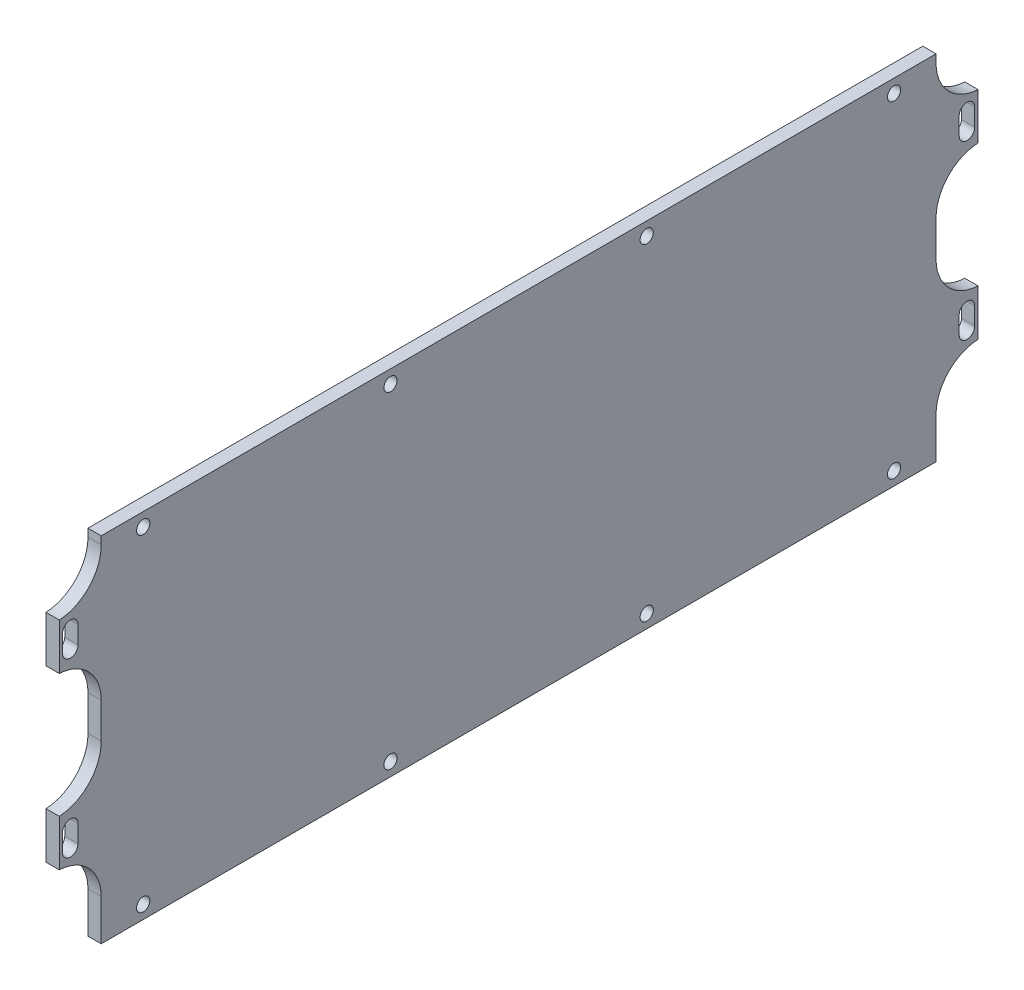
SolidWorks part; units mm, degrees
ref_plane "Front" through (0, 0, 0) normal (0, 0, 1) x (1, 0, 0)
ref_plane "Top" through (0, 0, 0) normal (0, 1, 0) x (1, 0, 0)
ref_plane "Right" through (0, 0, 0) normal (1, 0, 0) x (0, 0, -1)
sketch "Эскиз1" plane through (0, 0, 0) normal (1, 0, 0) x (0, 0, -1)
  line L1 (-104.5, -42) -> (104.5, -42)
  line L2 (-104.5, -42) -> (-104.5, 42)
  line L3 (-104.5, 42) -> (104.5, 42)
  line L4 (104.5, -42) -> (104.5, 42)
  line L5 (-104.5, -42) -> (104.5, 42) construction
  line L6 (-104.5, 42) -> (104.5, -42) construction
  point P0 (0, 0)
  dimension "D1" = 209
  dimension "D2" = 84
extrude "Бобышка-Вытянуть1" add sketch "Эскиз1" along normal blind 3
sketch "Эскиз2" plane through (3, 0, 0) normal (1, 0, 0) x (0, 0, -1)
  line L0 (104.5, 21.25) -> (101.5, 21.25) construction
  line L1 (104.5, 21.25) -> (119.9005, 21.25) construction
  line L2 (104.5, 32) -> (104.5, 12.5261) construction
  line L3 (104.5, -42) -> (104.5, 42) construction
  line L4 (101.5, 21.25) -> (101.5, -17.75) construction
  line L5 (0, 42) -> (0, 21.25) construction
  line L6 (104.5, 42) -> (-104.5, 42) construction
  circle A0 centre (101.5, 21.25) radius 1.75
  circle A1 centre (101.5, -17.75) radius 1.75
  circle A2 centre (-101.5, -17.75) radius 1.75
  circle A3 centre (-101.5, 21.25) radius 1.75
  dimension "D2" = 3.5
  dimension "D4" = 3.5
  dimension "D1" = 3
  dimension "D3" = 39
extrude "Вырез-Вытянуть1" cut sketch "Эскиз2" against normal blind 10
sketch "Эскиз4" plane through (0, -42, 0) normal (0, -1, 0) x (-1, 0, 0)
  circle A0 centre (-1.6741, 1.2422) radius 175.4879
extrude "Вырез-Вытянуть3" cut sketch "Эскиз4" against normal blind 2
sketch "Эскиз5" plane through (0, 42, 0) normal (0, 1, 0) x (1, 0, 0)
  circle A0 centre (1.5428, -2.303) radius 130.715
extrude "Вырез-Вытянуть4" cut sketch "Эскиз5" against normal blind 2
sketch "Эскиз6" plane through (3, 0, 0) normal (1, 0, 0) x (0, 0, -1)
  line L0 (101.5, 21.25) -> (101.5, 24.25) construction
  line L1 (101.5, 24.25) -> (104.5, 24.25) construction
  line L2 (104.5, -40) -> (104.5, 40) construction
  line L3 (101.5, -17.75) -> (101.5, -20.75) construction
  line L4 (104.5, 24.25) -> (94.5, 24.25)
  line L5 (104.5, 24.25) -> (104.5, 43.8315)
  line L6 (104.5, 43.8315) -> (94.5, 43.8315)
  line L7 (94.5, 24.25) -> (94.5, 43.8315)
  line L8 (101.5, -20.75) -> (104.5, -20.75) construction
  line L9 (0, 0) -> (0, -11.4512) construction
  line L10 (104.5, -20.75) -> (94.5, -20.75)
  line L11 (104.5, -20.75) -> (104.5, -47.1827)
  line L12 (104.5, -47.1827) -> (94.5, -47.1827)
  line L13 (94.5, -20.75) -> (94.5, -47.1827)
  line L14 (-104.5, -47.1827) -> (-94.5, -47.1827)
  line L15 (-104.5, -20.75) -> (-104.5, -47.1827)
  line L16 (-104.5, -20.75) -> (-94.5, -20.75)
  line L17 (-94.5, -20.75) -> (-94.5, -47.1827)
  line L18 (-104.5, 24.25) -> (-104.5, 43.8315)
  line L19 (-104.5, 43.8315) -> (-94.5, 43.8315)
  line L20 (-94.5, 24.25) -> (-94.5, 43.8315)
  line L21 (-104.5, 24.25) -> (-94.5, 24.25)
  dimension "D1" = 3
  dimension "D2" = 10
  dimension "D3" = 3
  dimension "D4" = 10
extrude "Вырез-Вытянуть5" cut sketch "Эскиз6" against normal blind 10
sketch "Эскиз7" plane through (3, 0, 0) normal (1, 0, 0) x (0, 0, -1)
  line L0 (104.5, 1.75) -> (99.5, 1.75) construction
  line L1 (104.5, -20.75) -> (104.5, 24.25) construction
  line L2 (0, 0) -> (0, 21.92) construction
  line L3 (94.5, 17.75) -> (104.5, 17.75)
  line L4 (94.5, 17.75) -> (94.5, -14.25)
  line L5 (94.5, -14.25) -> (104.5, -14.25)
  line L6 (104.5, 17.75) -> (104.5, -14.25)
  line L7 (94.5, 17.75) -> (104.5, -14.25) construction
  line L8 (94.5, -14.25) -> (104.5, 17.75) construction
  line L9 (-94.5, -14.25) -> (-104.5, -14.25)
  line L10 (-94.5, 17.75) -> (-94.5, -14.25)
  line L11 (-94.5, 17.75) -> (-104.5, 17.75)
  line L12 (-104.5, 17.75) -> (-104.5, -14.25)
  dimension "D1" = 5
  dimension "D2" = 32
extrude "Вырез-Вытянуть6" cut sketch "Эскиз7" against normal blind 10
sketch "Эскиз8" plane through (3, 0, 0) normal (1, 0, 0) x (0, 0, -1)
  line L0 (0, 0) -> (29.6404, 0) construction
  line L3 (0, 0) -> (0, 37) construction
  line L4 (0, 37) -> (-29, 37) construction
  line L5 (-29, 37) -> (-85, 37) construction
  circle A0 centre (-29, 37) radius 1.5
  circle A1 centre (-85, 37) radius 1.5
  circle A2 centre (85, 37) radius 1.5
  circle A3 centre (29, 37) radius 1.5
  circle A4 centre (-85, -37) radius 1.5
  circle A5 centre (-29, -37) radius 1.5
  circle A6 centre (29, -37) radius 1.5
  circle A7 centre (85, -37) radius 1.5
  dimension "D4" = 3
  dimension "D5" = 3
  dimension "D1" = 37
  dimension "D2" = 29
  dimension "D3" = 56
extrude "Вырез-Вытянуть7" cut sketch "Эскиз8" against normal blind 10
sketch "Эскиз9" plane through (0, 0, 104.5) normal (0, 0, 1) x (1, 0, 0)
  circle A0 centre (1.1102, 20.2496) radius 49.6971
extrude "Вырез-Вытянуть8" cut sketch "Эскиз9" against normal blind 0.5
sketch "Эскиз10" plane through (0, 0, -104.5) normal (0, 0, -1) x (-1, 0, 0)
  circle A0 centre (-1.8555, 19.5935) radius 64.8536
extrude "Вырез-Вытянуть9" cut sketch "Эскиз10" against normal blind 0.5
sketch "Эскиз11" plane through (0, 24.25, 0) normal (0, 1, 0) x (1, 0, 0)
  line L1 (0, -94.5) -> (3, -94.5)
  line L2 (0, -94.5) -> (0, -104)
  line L3 (0, -104) -> (3, -104)
  line L4 (3, -94.5) -> (3, -104)
  line L5 (3, 94.5) -> (0, 94.5)
  line L6 (3, 94.5) -> (3, 104)
  line L7 (3, 104) -> (0, 104)
  line L8 (0, 94.5) -> (0, 104)
extrude "Бобышка-Вытянуть2" add sketch "Эскиз11" along normal blind 4
sketch "Эскиз12" plane through (0, -14.25, 0) normal (0, 1, 0) x (1, 0, 0)
  line L1 (3, 94.5) -> (0, 94.5)
  line L2 (3, 94.5) -> (3, 104)
  line L3 (3, 104) -> (0, 104)
  line L4 (0, 94.5) -> (0, 104)
  line L5 (3, -104) -> (0, -104)
  line L6 (3, -104) -> (3, -94.5)
  line L7 (3, -94.5) -> (0, -94.5)
  line L8 (0, -104) -> (0, -94.5)
extrude "Бобышка-Вытянуть3" add sketch "Эскиз12" along normal blind 4
sketch "Эскиз13" plane through (3, 0, 0) normal (1, 0, 0) x (0, 0, -1)
  line L0 (-101.5, 21.25) -> (-101.5, 25.25) construction
  line L1 (-103.25, 25.25) -> (-103.25, 21.25)
  line L2 (-99.75, 25.25) -> (-99.75, 21.25)
  line L3 (0, 0) -> (0, 23.2004) construction
  line L4 (99.75, 25.25) -> (99.75, 21.25)
  line L5 (103.25, 25.25) -> (103.25, 21.25)
  line L6 (-101.5, 21.25) -> (-101.5, -17.75) construction
  line L7 (99.75, -13.75) -> (99.75, -17.75)
  line L8 (103.25, -13.75) -> (103.25, -17.75)
  line L9 (-103.25, -13.75) -> (-103.25, -17.75)
  line L10 (-99.75, -13.75) -> (-99.75, -17.75)
  arc A0 (-103.25, 21.25) -> (-99.75, 21.25) centre (-101.5, 21.25) ccw
  arc A1 (-99.75, 25.25) -> (-103.25, 25.25) centre (-101.5, 25.25) ccw
  circle A2 centre (-101.5, 21.25) radius 1.75 construction
  arc A3 (103.25, 21.25) -> (99.75, 21.25) centre (101.5, 21.25) cw
  arc A4 (99.75, 25.25) -> (103.25, 25.25) centre (101.5, 25.25) cw
  arc A5 (99.75, -13.75) -> (103.25, -13.75) centre (101.5, -13.75) cw
  arc A6 (-103.25, -17.75) -> (-99.75, -17.75) centre (-101.5, -17.75) ccw
  arc A7 (-99.75, -13.75) -> (-103.25, -13.75) centre (-101.5, -13.75) ccw
  arc A8 (103.25, -17.75) -> (99.75, -17.75) centre (101.5, -17.75) cw
  dimension "D1" = 4
extrude "Вырез-Вытянуть10" cut sketch "Эскиз13" against normal through all
fillet "Скругление1" radius 10 8 edges at (1.5, -20.75, -94.5) (1.5, -10.25, -94.5) (1.5, 17.75, -94.5) (1.5, 28.25, -94.5) (1.5, -20.75, 94.5) (1.5, -10.25, 94.5) (1.5, 17.75, 94.5) (1.5, 28.25, 94.5)
